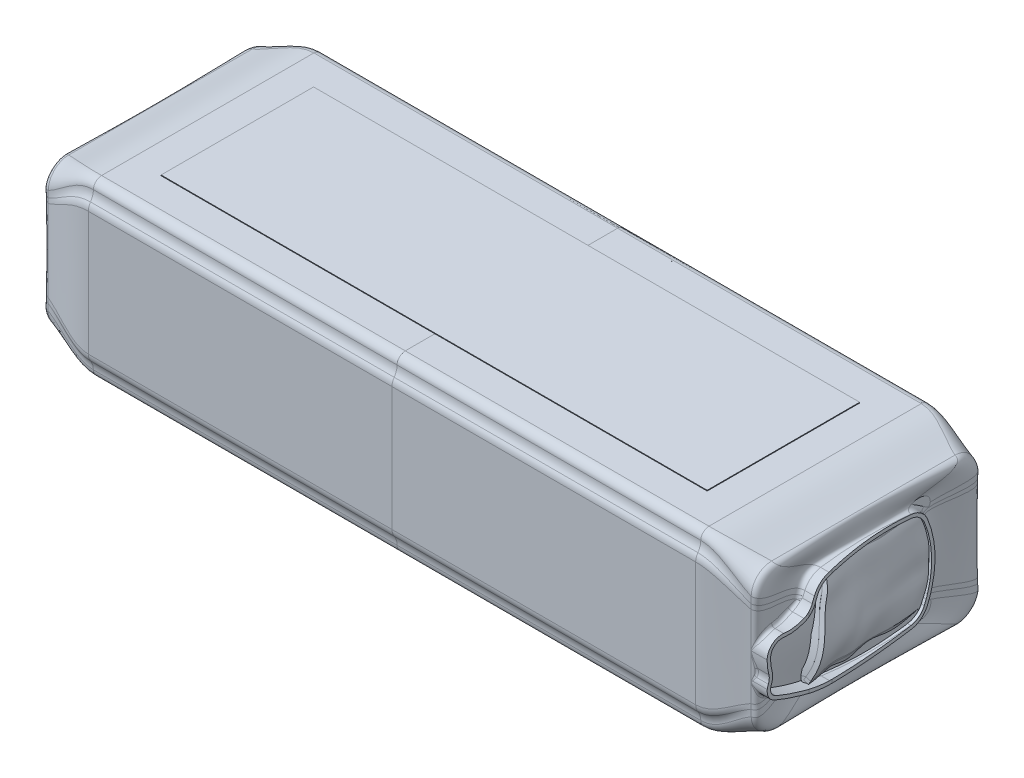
SolidWorks part; units mm, degrees
ref_plane "前视基准面" through (0, 0, 0) normal (0, 0, 1) x (1, 0, 0)
ref_plane "上视基准面" through (0, 0, 0) normal (0, 1, 0) x (1, 0, 0)
ref_plane "右视基准面" through (0, 0, 0) normal (1, 0, 0) x (0, 0, -1)
imported_body "2200mAh LiPo.stp-1/Batt.stp-1/Inner end.stp-1-solid1"
imported_body "2200mAh LiPo.stp-1/Batt.stp-1/Inner front end.stp-1-solid1"
imported_body "2200mAh LiPo.stp-1/Batt.stp-1/Inner front end.stp-1-solid2"
imported_body "2200mAh LiPo.stp-1/Batt.stp-1/Casing.stp-1-solid1"
imported_body "2200mAh LiPo.stp-1/Label.stp-1-solid1"
scale "缩放比例1" bodies to scale 102 101 104 105 103 scale about origin uniform scaling yes scale factor 1.5
ref_point "点1"
